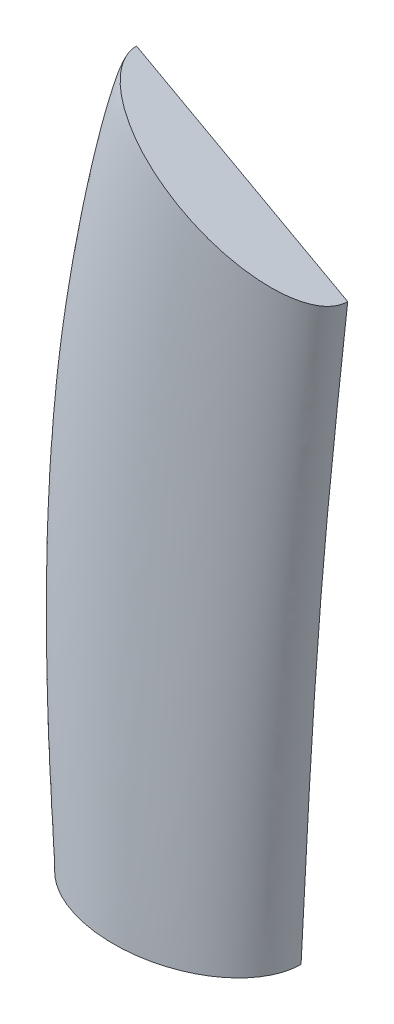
SolidWorks part; units mm, degrees
ref_plane "Front Plane" through (0, 0, 0) normal (0, 0, 1) x (1, 0, 0)
ref_plane "Top Plane" through (0, 0, 0) normal (0, 1, 0) x (1, 0, 0)
ref_plane "Right Plane" through (0, 0, 0) normal (1, 0, 0) x (0, 0, -1)
sketch "Sketch1" plane through (0, 0, 0) normal (0, 0, 1) x (1, 0, 0)
  line L0 (14.5622, 178) -> (67.2748, 149.1066) construction
  spline S0 degree 3 poles (0, 0) (0.2864, 5.7654) (-11.0177, 84.9484) (11.4102, 172.6093) (14.5622, 178) knots 0 0 0 0 0.657313 1 1 1 1
  spline S1 degree 3 poles (55.63, 4.8929) (57.1391, 33.5819) (59.6738, 81.767) (65.0853, 129.7089) (67.2748, 149.1066) knots 0 0 0 0 0.59539 1 1 1 1
  dimension "D1" = 178
sketch "Sketch2" plane through (0, 0, 0) normal (0, 1, 0) x (1, 0, 0)
  line L0 (55.63, 0) -> (0, 0)
  ellipse E0 centre (27.815, 0) end of major axis (0, 0) minor radius 19 (0, 0) -> (55.63, 0) ccw
  dimension "D1" = 19
ref_plane "Plane1" through (78.3902, 143.014, 0) normal (-0.4807, -0.8769, 0) x (0.8769, -0.4807, 0)
sketch "Sketch3" plane through (78.3902, 143.014, 0) normal (-0.4807, -0.8769, 0) x (0.8769, -0.4807, 0)
  line L1 (-12.6756, 0) -> (-72.7876, 0)
  ellipse E0 centre (-42.7316, 0) end of major axis (-72.7876, 0) minor radius 15.25 (-72.7876, 0) -> (-12.6756, 0) cw
  dimension "D1" = 15.25
loft "Loft1" add profiles "Sketch2", "Sketch3"
sketch "Finger Grip" plane through (0, 0, 0) normal (0, 0, -1) x (-1, 0, 0)
  spline S0 degree 3 poles (-55.63, 0) (-55.6701, 0.787) (-56.4546, 16.2063) (-66.0365, 26.9063) (-65.5605, 36.0185) (-59.2274, 44.3172) (-59.6992, 66.1996) (-69.7325, 75.8774) (-70.414, 87.0102) (-56.2065, 105.5489) (-71.69, 125.1392) (-71.927, 130.6446) (-66.2233, 136.924) (-67.2243, 148.5171) (-67.2748, 149.1066) knots 0 0 0 0 0.010904 0.218082 0.218082 0.363536 0.363536 0.550014 0.550014 0.731464 0.859835 0.859835 0.992992 1 1 1 1
sketch "Thumb Rest" plane through (0, 0, 0) normal (0, 0, 1) x (1, 0, 0)
  line L0 (15.831, 163.7869) -> (19.6139, 170.7364)
  line L1 (19.6139, 170.7364) -> (56.1001, 150.8757)
  line L2 (56.1001, 150.8757) -> (54.2323, 114.9515)
  line L3 (54.2323, 114.9515) -> (43.5704, 118.4118)
  line L4 (43.5704, 118.4118) -> (15.831, 163.7869) construction
  arc A0 (43.5704, 118.4118) -> (15.831, 163.7869) centre (-28.4952, 105.522) ccw
  dimension "D1" = 120
  dimension "D2" = 5
sketch "Split Sketch" plane through (0, 0, 0) normal (0, 0, 1) x (1, 0, 0)
  arc A0 (62.2976, 166.0047) -> (44.719, -24.8157) centre (344.0262, 43.8317) ccw
